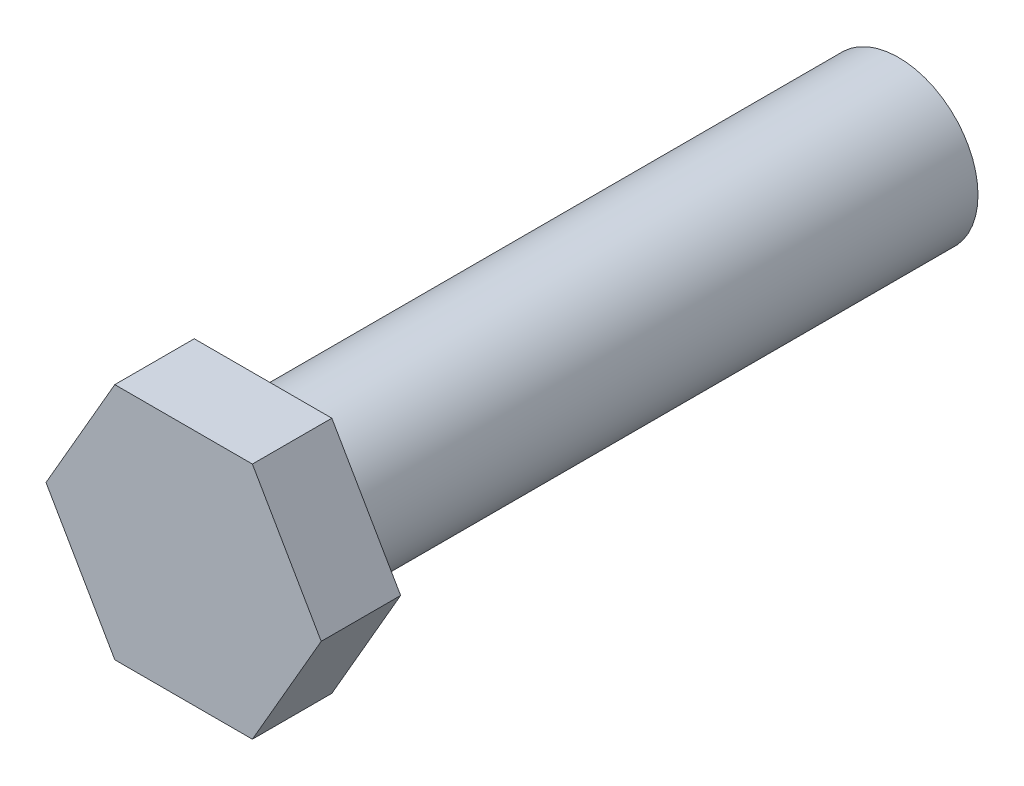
SolidWorks part; units mm, degrees
ref_plane "Front" through (0, 0, 0) normal (0, 0, 1) x (1, 0, 0)
ref_plane "Top" through (0, 0, 0) normal (0, 1, 0) x (1, 0, 0)
ref_plane "Right" through (0, 0, 0) normal (1, 0, 0) x (0, 0, -1)
sketch "Sketch1" plane through (0, 0, 0) normal (0, 0, 1) x (1, 0, 0)
  circle A0 centre (0, 0) radius 5
  dimension "D1" = 10
extrude "Extrude1" add sketch "Sketch1" along normal blind 40
sketch "Sketch2" plane through (0, 0, 40) normal (0, 0, 1) x (1, 0, 0)
  line L1 (8.6603, 0) -> (4.3301, 7.5)
  line L2 (4.3301, 7.5) -> (-4.3301, 7.5)
  line L3 (-4.3301, 7.5) -> (-8.6603, 0)
  line L4 (-8.6603, 0) -> (-4.3301, -7.5)
  line L5 (-4.3301, -7.5) -> (4.3301, -7.5)
  line L6 (4.3301, -7.5) -> (8.6603, 0)
  circle A0 centre (0, 0) radius 7.5 construction
  dimension "D1" = 15
extrude "Extrude2" add sketch "Sketch2" along normal blind 5
